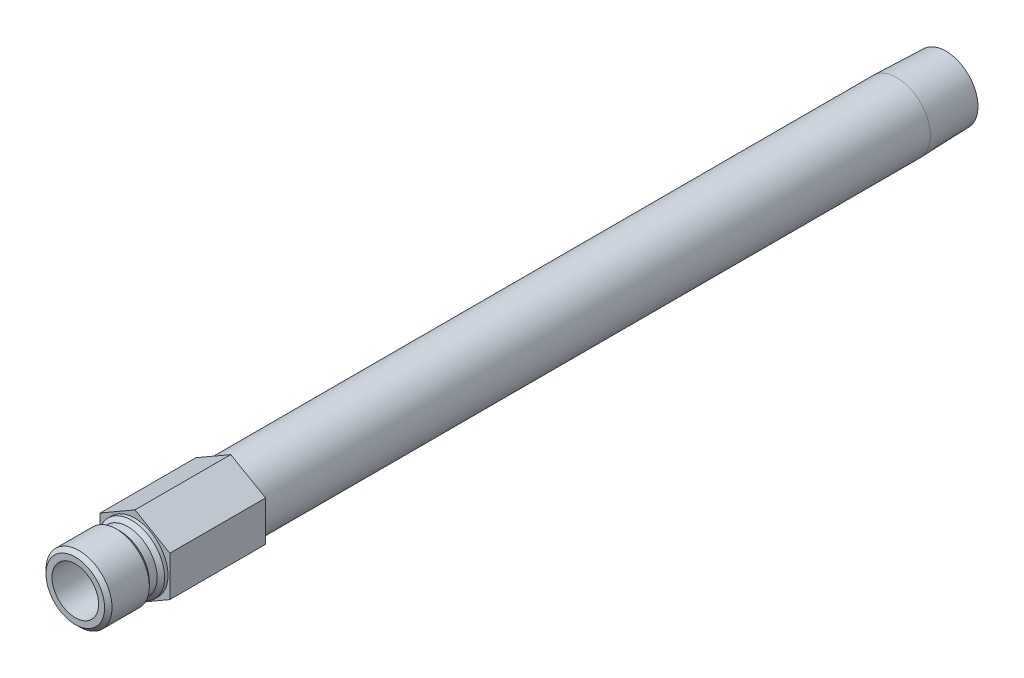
SolidWorks part; units mm, degrees
ref_plane "Front Plane" through (0, 0, 0) normal (0, 0, 1) x (1, 0, 0)
ref_plane "Top Plane" through (0, 0, 0) normal (0, 1, 0) x (1, 0, 0)
ref_plane "Right Plane" through (0, 0, 0) normal (1, 0, 0) x (0, 0, -1)
sketch "Sketch1" plane through (0, 0, 0) normal (1, 0, 0) x (0, 0, -1)
  line L0 (0, 0) -> (-15.367, 0) construction
  line L1 (-12.192, 4.7625) -> (-12.192, 5.9817)
  line L2 (-3.048, 5.9817) -> (-3.048, 0) construction
  line L3 (-11.43, 6.7437) -> (-3.81, 6.7437)
  line L4 (0, 6.858) -> (0, 4.7625) construction
  line L5 (-3.048, 5.9817) -> (-1.4605, 5.9817)
  line L6 (-0.6985, 6.7437) -> (0, 6.7437)
  line L7 (0, 6.7437) -> (0, 6.858)
  line L8 (-3.048, 5.9817) -> (-3.81, 6.7437)
  line L9 (-1.4605, 5.9817) -> (-0.6985, 6.7437)
  line L10 (-12.192, 5.9817) -> (-11.43, 6.7437)
  line L11 (-12.192, 4.7625) -> (0, 4.7625)
  line L12 (0, 6.858) -> (155.575, 6.858)
  line L13 (155.575, 6.858) -> (165.608, 6.5445)
  line L14 (165.608, 6.5445) -> (165.608, 4.6228)
  line L15 (0, 6.7437) -> (19.558, 6.7437) construction
  line L16 (19.558, 6.7437) -> (19.558, 0) construction
  line L17 (19.558, 0) -> (0, 0) construction
  line L19 (0.0743, 4.6228) -> (165.608, 4.6228)
  line L20 (0, 4.7625) -> (0.0743, 4.6228)
  line L21 (0, 4.6272) -> (0, 0) construction
  dimension "D2" = 1.5875
  dimension "D3" = 0.762
  dimension "D4" = 45
  dimension "D5" = 9.144
  dimension "D6" = 45
  dimension "D7" = 1.79
  dimension "D8" = 10.033
  dimension "D9" = 177.8
  dimension "D10" = 3.175
  dimension "D11" = 9.525
  dimension "D12" = 13.716
  dimension "D13" = 31.75
  dimension "D14" = 13.4874
  dimension "D15" = 9.2456
  dimension "D16" = 19.558
  dimension "D17" = 118
  dimension "D18" = 12.192
revolve "Revolve1" add sketch "Sketch1" angle 360 about L0
sketch "Sketch2" plane through (0, 0, 0) normal (0, 0, 1) x (1, 0, 0)
  line L1 (-7.112, 4.1061) -> (-7.112, -4.1061)
  line L2 (-7.112, -4.1061) -> (0, -8.2122)
  line L3 (0, -8.2122) -> (7.112, -4.1061)
  line L4 (7.112, -4.1061) -> (7.112, 4.1061)
  line L5 (7.112, 4.1061) -> (0, 8.2122)
  line L6 (0, 8.2122) -> (-7.112, 4.1061)
  circle A0 centre (0, 0) radius 7.112 construction
  circle A1 centre (0, 0) radius 4.6228 construction
  circle A2 centre (0, 0) radius 4.6228
  dimension "D1" = 14.224
extrude "Boss-Extrude1" add sketch "Sketch2" against normal up to vertex (19.558 mm away) from vertex at 0
